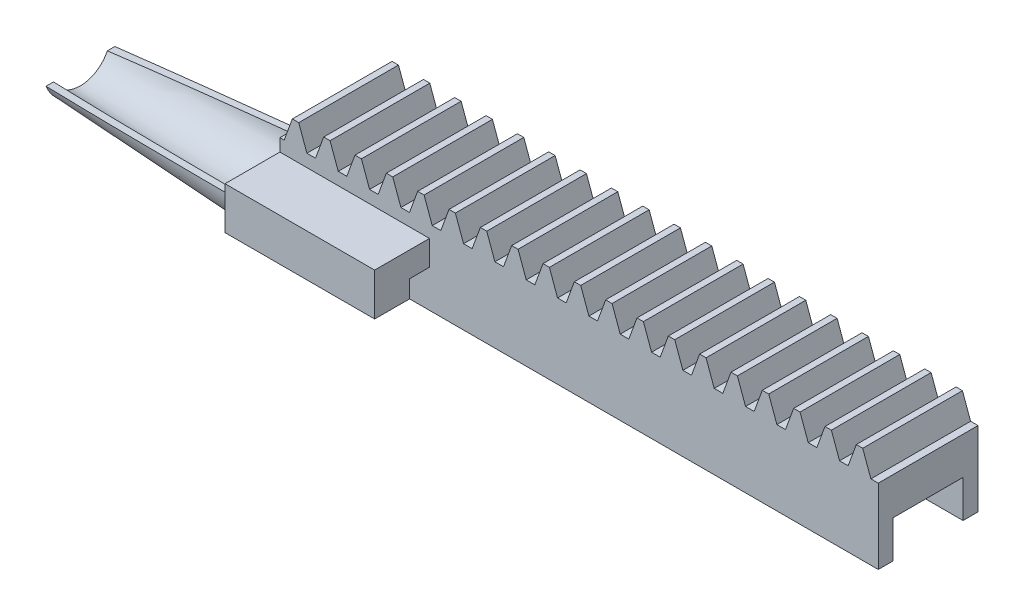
SolidWorks part; units mm, degrees
extrude "Blank" add sketch "BlankSke" against normal blind 20
sketch "BlankSke" plane through (0, 0, 0) normal (0, 0, 1) x (1, 0, 0)
  line L1 (0, 0) -> (120, 0)
  line L2 (0, 0) -> (0, 12)
  line L3 (0, 12) -> (120, 12)
  line L4 (120, 0) -> (120, 12)
ref_plane "Plane1" through (0, 0, 0) normal (0, 0, 1) x (1, 0, 0)
ref_plane "Plane2" through (0, 0, 0) normal (0, 1, 0) x (1, 0, 0)
ref_plane "Plane3" through (0, 0, 0) normal (1, 0, 0) x (0, 0, -1)
other "Configuration Table"
sketch "HoldingSke" plane through (0, 0, 0) normal (0, 1, 0) x (1, 0, 0)
  line L0 (0, 0) -> (0.0696, 0.4951)
  line L1 (-15, 0) -> (100, 0) construction
  line L2 (0, 0) -> (-2.1039, 2.3779)
  line L3 (0, 0) -> (-11.863, 4.5341)
  line L4 (0, 0) -> (8.0624, 3.0949)
  line L5 (0, 0) -> (-23.7986, -8.8762)
  line L6 (0, 0) -> (-10.5278, -7.1032)
  line L9 (-71.009, 38.7566) -> (41.7541, 79.799)
  line L10 (-76.2, 4.3779) -> (-66.2, 4.3779)
  line L11 (0, 0) -> (-10, 0)
  line L12 (-76.2, 101.6) -> (-76.133, 101.6)
  line L13 (24.9733, 27.94) -> (52.9518, 28.4284)
  line L14 (24.9733, 27.94) -> (24.9743, 27.94)
  line L15 (24.9733, 27.94) -> (100.4006, 29.5858)
  circle A0 centre (0, 0) radius 19.05
  circle A1 centre (0, 0) radius 5
  circle A2 centre (0, 0) radius 12.7
sketch "TooCutSkeIll" plane through (0, 0, 0) normal (0, 0, 1) x (1, 0, 0)
  line L0 (-2.4806, 11.9474) -> (-0.9819, 7.8296)
  line L1 (-0.5111, 7.5) -> (0.5111, 7.5)
  line L2 (0.9819, 7.8296) -> (2.4806, 11.9474)
  line L3 (120, 12) -> (0, 12) construction
  line L4 (0, 0) -> (0, 64.897) construction
  line L5 (-13.208, 10) -> (12.954, 10) construction
  line L6 (0, 0) -> (120, 0) construction
  line L7 (1.7718, 10) -> (1.7718, 48.7463) construction
  line L8 (-1.7718, 10) -> (-1.7718, 48.7463) construction
  line L9 (2.5558, 12) -> (2.5558, 12.0254)
  line L10 (-2.5558, 12) -> (-2.5558, 12.0254)
  line L11 (-2.5558, 12.0254) -> (2.5558, 12.0254)
  arc A0 (0.5111, 7.5) -> (0.9819, 7.8296) centre (0.5111, 8.001) ccw
  arc A1 (-0.9819, 7.8296) -> (-0.5111, 7.5) centre (-0.5111, 8.001) ccw
  arc A2 (2.5558, 12) -> (2.4806, 11.9474) centre (2.5558, 11.92) ccw
  arc A3 (-2.4806, 11.9474) -> (-2.5558, 12) centre (-2.5558, 11.92) ccw
extrude "ToothCutIll" [suppressed] cut sketch "TooCutSkeIll" against normal through all
sketch "TooCutSkeSim" plane through (0, 0, 0) normal (0, 0, 1) x (1, 0, 0)
  line L0 (0.8619, 7.5) -> (-0.8619, 7.5)
  line L1 (2.509, 12.0254) -> (0.8619, 7.5)
  line L2 (0, 17.4625) -> (0, 53.467) construction
  line L3 (2.509, 12.0254) -> (-2.509, 12.0254)
  line L6 (-2.509, 12.0254) -> (-0.8619, 7.5)
  line L9 (-1.7718, 10) -> (1.7718, 10) construction
  line L10 (0, 0) -> (120, 0) construction
  line L11 (1.7718, 10) -> (1.7718, 53.467) construction
  line L12 (-1.7718, 10) -> (-1.7718, 53.467) construction
extrude "ToothCutSim" cut sketch "TooCutSkeSim" against normal through all
pattern_linear "TeethCuts" count 20 spacing 6.2832 along (1, 0, 0) of "ToothCutIll", "ToothCutSim"
sketch "草图1" plane through (0, 0, 0) normal (0, -1, 0) x (1, 0, 0)
  line L0 (120, -20) -> (0, -20)
  line L1 (0, -20) -> (0, -17)
  line L2 (0, -20) -> (0, 0) construction
  line L3 (0, -17) -> (120, -17)
  line L4 (120, -20) -> (120, 0) construction
  line L5 (120, -17) -> (120, -20)
  line L6 (120, -10) -> (0, -10) construction
  line L7 (0, -3) -> (120, -3)
  line L8 (0, 0) -> (0, -3)
  line L9 (120, 0) -> (0, 0)
  line L10 (120, -3) -> (120, 0)
  dimension "D1" = 3
extrude "凸台-拉伸1" add sketch "草图1" along normal blind 7.5
sketch "草图3" plane through (0, 0, 0) normal (-1, 0, 0) x (0, 0, 1)
  line L0 (0, -7.5) -> (-29.3324, -7.5) construction
  line L1 (-10, 12) -> (-10, -30.8459) construction
  line L2 (0, 12) -> (-20, 12) construction
  line L3 (-20, -7.5) -> (0, -7.5) construction
  line L5 (-20, -7.5) -> (0, -7.5)
  arc A0 (-20, -7.5) -> (0, -7.5) centre (-10, -7.5) ccw
extrude "凸台-拉伸2" add sketch "草图3" along normal blind 50 draft 3 separate body
sketch "草图4" plane through (-50, 0, 0) normal (-1, 0, 0) x (0, 0, 1)
  line L0 (0, -7.5) -> (-20, -7.5) construction
  line L1 (-16, -7.5) -> (-4, -7.5)
  arc A0 (-16, -7.5) -> (-4, -7.5) centre (-10, -7.5) ccw
  dimension "D1" = 12
extrude "切除-拉伸1" cut sketch "草图4" against normal blind 50 draft 3
ref_plane "基准面1" through (0, 0, -10) normal (0, 0, 1) x (1, 0, 0)
sketch "草图9" plane through (0, 0, 0) normal (-1, 0, 0) x (0, 0, 1)
  line L0 (0, 0) -> (0, 5)
  line L1 (0, 7.5) -> (0, -7.5) construction
  line L2 (0, 5) -> (11, 5)
  line L3 (11, 5) -> (11, -3.5)
  line L4 (11, -0.0192) -> (11, -3.5192) construction
  line L6 (11, -3.5) -> (4, -3.5192)
  line L7 (11, -3.5192) -> (4, -3.5192) construction
  line L8 (4, -3.5192) -> (4, -0.0192)
  line L9 (4, -0.0192) -> (0, 0)
  dimension "D1" = 5
  dimension "D2" = 7.5
  dimension "D3" = 11
  dimension "D4" = 8.5
  dimension "D5" = 7
extrude "凸台-拉伸3" add sketch "草图9" against normal blind 30
equation "' \"Module@HoldingSke\" = 6.35"
equation "' \"Num_teeth@HoldingSke\" = 12"
equation "' \"Ap@HoldingSke\" =  20"
equation "' \"Ap@HoldingSke\" = 20"
equation "' \"Width@HoldingSke\" = 0.25 * 25.4"
equation "' \"Show_teeth@HoldingSke\" = 500"
equation "' \"Backlash@HoldingSke\" = 0.009 * 25.4"
equation "' \"Addendum_fac@HoldingSke\" = 1.0"
equation "' \"Dedendum_fac@HoldingSke\" = 1.25"
equation "' \"Dedendum_add@HoldingSke\" = 0.00005 * 25.4"
equation "' \"Clearance_fac@HoldingSke\" = 0.25"
equation "' \"Pitch_height@HoldingSke\" = 1 * 25.4"
equation "' \"Length@HoldingSke\" = 4.71 * 25.4"
equation "\"Pitch@HoldingSke\" = 1 / \"Module@HoldingSke\""
equation "\"MPH@HoldingSke\" = \"Dedendum_fac@HoldingSke\" / \"Pitch@HoldingSke\" + 2 * \"Dedendum_add@HoldingSke\" + 0.002 * 25.4"
equation "\"MPH@HoldingSke\" = ((sgn( \"MPH@HoldingSke\" - \"Pitch_height@HoldingSke\")+1)*( \"MPH@HoldingSke\" - \"Pitch_height@HoldingSke\"))/2 + \"Pitch_height@HoldingSke\""
equation "\"Blank_height@BlankSke\" = \"Pitch_height@HoldingSke\" + \"Addendum_fac@HoldingSke\"  / \"Pitch@HoldingSke\" "
equation "\"Length@BlankSke\" =  \"Length@HoldingSke\""
equation "\"Pressure_angle@TooCutSkeIll\" = \"Ap@HoldingSke\""
equation "\"Addendum_plus@TooCutSkeIll\" =  \"Addendum_fac@HoldingSke\"  / \"Pitch@HoldingSke\" + 0.001 *25.4"
equation "\"Dedendum@TooCutSkeIll\" = \"Dedendum_fac@HoldingSke\"  / \"Pitch@HoldingSke\""
equation "\"Pitch_height@TooCutSkeIll\" =  \"MPH@HoldingSke\""
equation "\"Gap_width@TooCutSkeIll\" = 3.14159265 / 2 / \"Pitch@HoldingSke\" + 6 * \"Backlash@HoldingSke\""
equation "\"Pressure_angle@TooCutSkeSim\" = \"Ap@HoldingSke\""
equation "\"Addendum_plus@TooCutSkeSim\" =  \"Addendum_fac@HoldingSke\"  / \"Pitch@HoldingSke\" + 0.001 * 25.4"
equation "\"Dedendum@TooCutSkeSim\" = \"Dedendum_fac@HoldingSke\"  / \"Pitch@HoldingSke\""
equation "\"Pitch_height@TooCutSkeSim\" =  \"MPH@HoldingSke\""
equation "\"Gap_width@TooCutSkeSim\" = 3.14159265 / 2 / \"Pitch@HoldingSke\" + 6 * \"Backlash@HoldingSke\""
equation "\"Root_fillet@TooCutSkeIll\" = \"Clearance_fac@HoldingSke\" / \"Pitch@HoldingSke\" + \"Dedendum_add@HoldingSke\""
equation "\"Break_rad@TooCutSkeIll\" = 0.02 / \"Pitch@HoldingSke\" * 2"
equation "\"Linear_pitch@TeethCuts\" = 3.14159265 / \"Pitch@HoldingSke\""
equation "\"Num_teeth@HoldingSke\" = int( ( \"Length@HoldingSke\" + 0 ) / (3.14159265 / \"Pitch@HoldingSke\")) + 0.9999  + 1"
equation " \"Num_teeth@TeethCuts\" = int( \"Show_teeth@HoldingSke\" ) + 1"
equation " \"Num_teeth@TeethCuts\" = ((sgn( \"Num_teeth@TeethCuts\" - \"Num_teeth@HoldingSke\" )-1)*( \"Num_teeth@TeethCuts\" - \"Num_teeth@HoldingSke\" ))/-2+ \"Num_teeth@HoldingSke\""
equation " \"Num_teeth@TeethCuts\" = ((sgn( \"Num_teeth@TeethCuts\" - 2.0)+1)*( \"Num_teeth@TeethCuts\" - 2.0))/2 +2.0"
